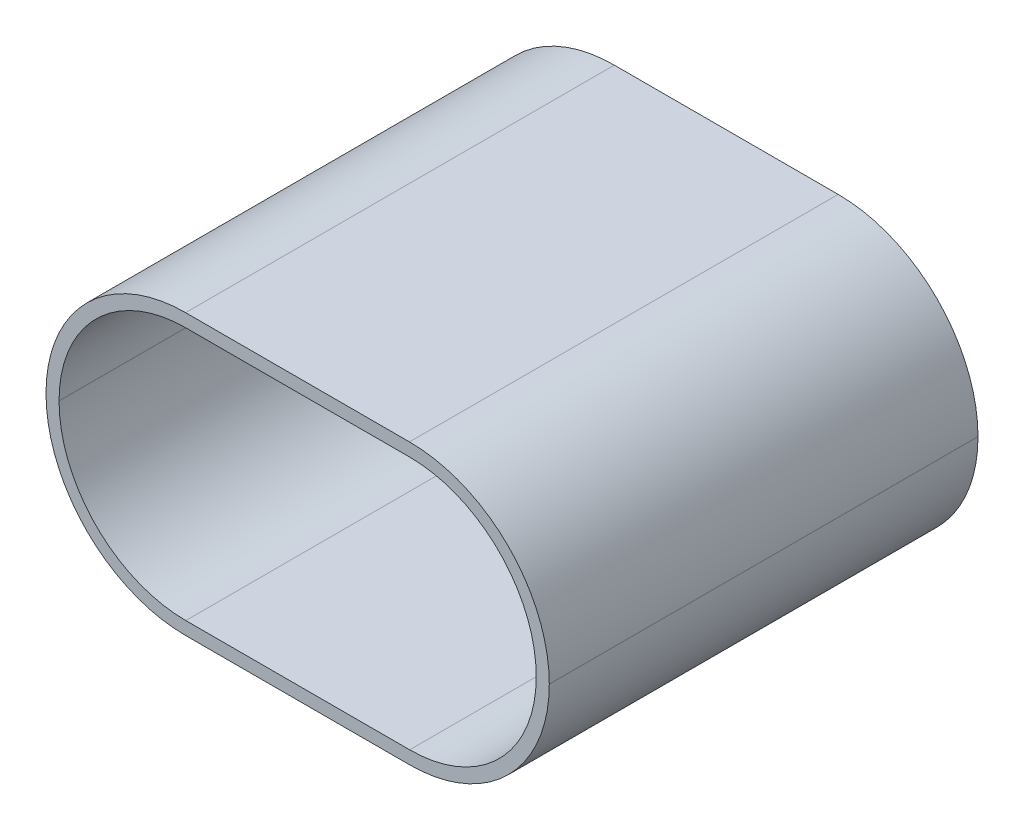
SolidWorks part; units mm, degrees
ref_plane "Plan de face" through (0, 0, 0) normal (0, 0, 1) x (1, 0, 0)
ref_plane "Plan de dessus" through (0, 0, 0) normal (0, 1, 0) x (1, 0, 0)
ref_plane "Plan de droite" through (0, 0, 0) normal (1, 0, 0) x (0, 0, -1)
sketch "Esquisse1" plane through (0, 0, 0) normal (0, 0, 1) x (1, 0, 0)
  line L4 (-8.8291, -21.6) -> (3.1809, -21.6)
  line L5 (10.6709, -14.11) -> (10.6709, -14.1)
  line L6 (3.1709, -6.6) -> (-8.8391, -6.6)
  line L7 (-16.3291, -14.09) -> (-16.3291, -14.1)
  line L12 (3.1709, -7.3) -> (-8.8391, -7.3)
  line L13 (-15.6291, -14.09) -> (-15.6291, -14.1)
  line L14 (-8.8291, -20.9) -> (3.1809, -20.9)
  line L15 (9.9709, -14.11) -> (9.9709, -14.1)
  arc A4 (3.1809, -21.6) -> (10.6709, -14.11) centre (3.1809, -14.11) ccw
  arc A5 (10.6709, -14.1) -> (3.1709, -6.6) centre (3.1709, -14.1) ccw
  arc A6 (-8.8391, -6.6) -> (-16.3291, -14.09) centre (-8.8391, -14.09) ccw
  arc A7 (-16.3291, -14.1) -> (-8.8291, -21.6) centre (-8.8291, -14.1) ccw
  arc A12 (9.9709, -14.1) -> (3.1709, -7.3) centre (3.1709, -14.1) ccw
  arc A13 (-8.8391, -7.3) -> (-15.6291, -14.09) centre (-8.8391, -14.09) ccw
  arc A14 (-15.6291, -14.1) -> (-8.8291, -20.9) centre (-8.8291, -14.1) ccw
  arc A15 (3.1809, -20.9) -> (9.9709, -14.11) centre (3.1809, -14.11) ccw
  dimension "D2" = 0.7
extrude "Extrusion1" add sketch "Esquisse1" against normal blind 24
sketch "Esquisse2" plane through (0, 0, 0) normal (0, 0, 1) x (1, 0, 0)
  line L4 (-8.8291, -21.6) -> (3.1809, -21.6)
  line L5 (10.6709, -14.11) -> (10.6709, -14.1)
  line L6 (3.1709, -6.6) -> (-8.8391, -6.6)
  line L7 (-16.3291, -14.09) -> (-16.3291, -14.1)
  line L8 (-8.8291, -21.6) -> (3.1809, -21.6)
  line L9 (10.6709, -14.11) -> (10.6709, -14.1)
  line L10 (3.1709, -6.6) -> (-8.8391, -6.6)
  line L11 (-16.3291, -14.09) -> (-16.3291, -14.1)
  arc A4 (-16.3291, -14.1) -> (-8.8291, -21.6) centre (-8.8291, -14.1) ccw
  arc A5 (3.1809, -21.6) -> (10.6709, -14.11) centre (3.1809, -14.11) ccw
  arc A6 (10.6709, -14.1) -> (3.1709, -6.6) centre (3.1709, -14.1) ccw
  arc A7 (-8.8391, -6.6) -> (-16.3291, -14.09) centre (-8.8391, -14.09) ccw
  arc A8 (-16.3291, -14.1) -> (-8.8291, -21.6) centre (-8.8291, -14.1) ccw
  arc A9 (3.1809, -21.6) -> (10.6709, -14.11) centre (3.1809, -14.11) ccw
  arc A10 (10.6709, -14.1) -> (3.1709, -6.6) centre (3.1709, -14.1) ccw
  arc A11 (-8.8391, -6.6) -> (-16.3291, -14.09) centre (-8.8391, -14.09) ccw
  dimension "D1" = 0
extrude "Enlèv. mat.-Extru.1" cut sketch "Esquisse2" against normal blind 1
sketch "Esquisse3" plane through (0, 0, -24) normal (0, 0, -1) x (-1, 0, 0)
  line L1 (8.8391, -9.1) -> (-3.1709, -9.1)
  line L2 (-8.1709, -14.1) -> (-8.1709, -14.11)
  line L3 (-3.1809, -19.1) -> (8.8291, -19.1)
  line L4 (13.8291, -14.1) -> (13.8291, -14.09)
  line L5 (16.3291, -14.1) -> (16.3291, -14.09)
  line L6 (8.8391, -6.6) -> (-3.1709, -6.6)
  line L7 (-10.6709, -14.1) -> (-10.6709, -14.11)
  line L8 (-3.1809, -21.6) -> (8.8291, -21.6)
  line L9 (16.3291, -14.1) -> (16.3291, -14.09)
  line L10 (8.8391, -6.6) -> (-3.1709, -6.6)
  line L11 (-10.6709, -14.1) -> (-10.6709, -14.11)
  line L12 (-3.1809, -21.6) -> (8.8291, -21.6)
  arc A0 (-3.1709, -9.1) -> (-8.1709, -14.1) centre (-3.1709, -14.1) ccw
  arc A1 (-8.1709, -14.11) -> (-3.1809, -19.1) centre (-3.1809, -14.11) ccw
  arc A2 (8.8291, -19.1) -> (13.8291, -14.1) centre (8.8291, -14.1) ccw
  arc A3 (13.8291, -14.09) -> (8.8391, -9.1) centre (8.8391, -14.09) ccw
  arc A4 (8.8291, -21.6) -> (16.3291, -14.1) centre (8.8291, -14.1) ccw
  arc A5 (16.3291, -14.09) -> (8.8391, -6.6) centre (8.8391, -14.09) ccw
  arc A6 (-3.1709, -6.6) -> (-10.6709, -14.1) centre (-3.1709, -14.1) ccw
  arc A7 (-10.6709, -14.11) -> (-3.1809, -21.6) centre (-3.1809, -14.11) ccw
  arc A8 (8.8291, -21.6) -> (16.3291, -14.1) centre (8.8291, -14.1) ccw
  arc A9 (16.3291, -14.09) -> (8.8391, -6.6) centre (8.8391, -14.09) ccw
  arc A10 (-3.1709, -6.6) -> (-10.6709, -14.1) centre (-3.1709, -14.1) ccw
  arc A11 (-10.6709, -14.11) -> (-3.1809, -21.6) centre (-3.1809, -14.11) ccw
  dimension "D1" = 0
  dimension "D2" = 2.5
extrude "Extrusion2" add sketch "Esquisse3" against normal blind 1
